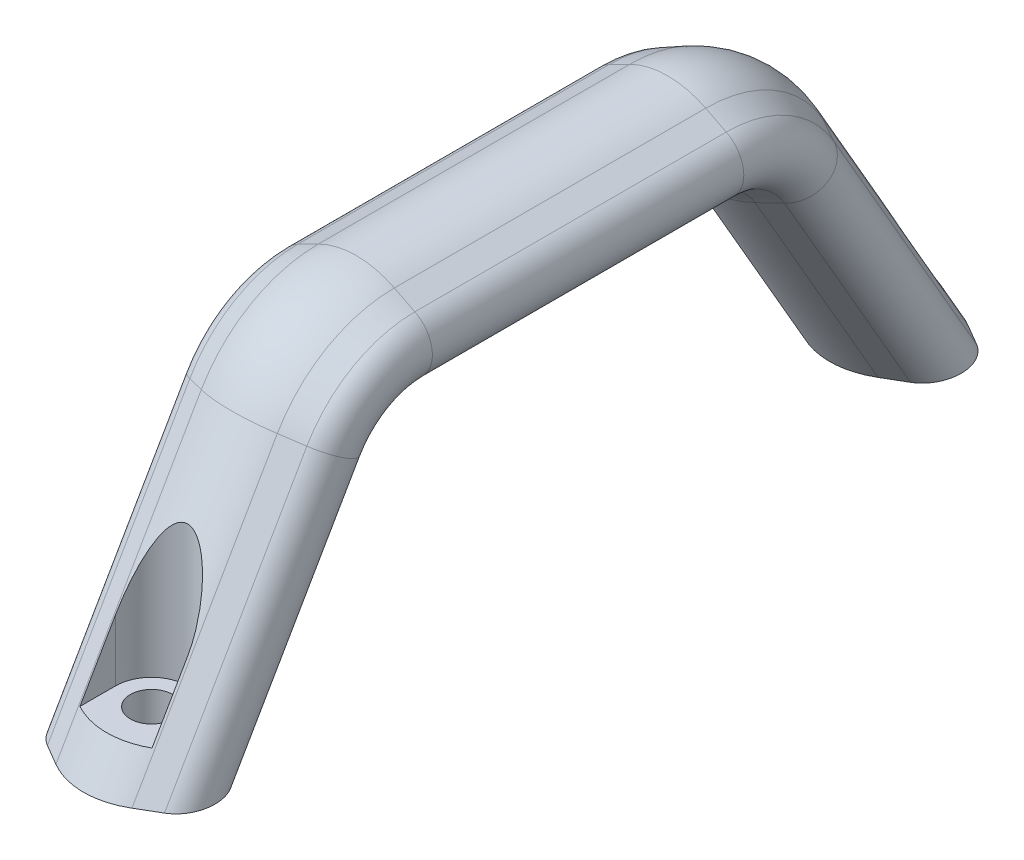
SolidWorks part; units mm, degrees
ref_plane "Front Plane" through (0, 0, 0) normal (0, 0, 1) x (1, 0, 0)
ref_plane "Top Plane" through (0, 0, 0) normal (0, 1, 0) x (1, 0, 0)
ref_plane "Right Plane" through (0, 0, 0) normal (1, 0, 0) x (0, 0, -1)
sketch "Axis_Line_L1" plane through (0, 0, 0) normal (0, 1, 0) x (1, 0, 0)
  line L0 (-7.5, 0) -> (7.5, 0) construction
  line L1 (-7.5, -53.5) -> (7.5, -53.5)
  dimension "FIX_1" = 15
  dimension "L1" = 107
ref_plane "Plane1" through (0, -23.1662, 13.375) normal (0, 0.866, -0.5) x (1, 0, 0)
sketch "Sketch2" plane through (0, 0, 0) normal (1, 0, 0) x (0, 0, -1)
  line L0 (-48.3038, -3) -> (-29.8286, 29)
  line L1 (-19.4363, 35) -> (19.4363, 35)
  line L2 (29.8286, 29) -> (48.3038, -3)
  line L3 (-53.5, 0) -> (-29.8286, 41) construction
  line L4 (-29.8286, 41) -> (29.8286, 41) construction
  line L5 (29.8286, 41) -> (53.5, 0) construction
  line L6 (-43.1077, -6) -> (-22.9004, 29) construction
  line L7 (-22.9004, 29) -> (22.9004, 29) construction
  line L8 (22.9004, 29) -> (43.1077, -6) construction
  line L9 (-42.275, -4.5578) -> (-22.9004, 29) construction
  line L10 (-52.6673, 1.4422) -> (-29.8286, 41) construction
  line L11 (22.9004, 29) -> (43.1077, -6) construction
  line L12 (29.8286, 41) -> (53.5, 0) construction
  line L13 (-47.4712, -1.5578) -> (-26.3645, 35) construction
  line L14 (-53.5, 0) -> (-43.1077, -6) construction
  line L15 (0, 0) -> (0, 41) construction
  line L16 (26.3645, 35) -> (48.3038, -3) construction
  line L17 (-26.3645, 35) -> (26.3645, 35) construction
  arc A0 (19.4363, 35) -> (29.8286, 29) centre (19.4363, 23) cw
  arc A1 (-29.8286, 29) -> (-19.4363, 35) centre (-19.4363, 23) cw
  point P3 (0, 35)
  point P14 (-48.3038, -3)
  dimension "FIX_4" = 12
  dimension "FIX_3" = 120
  dimension "H_s" = 29
  dimension "L1" = 107
  dimension "H" = 41
sketch "Sketch1" plane through (0, 26.75, 99.8324) normal (0, -0.866, 0.5) x (1, 0, 0)
  line L1 (0, -53.5) -> (0, -65.5) construction
  line L2 (-7.3079, -55.9319) -> (-4.7457, -54.6337)
  line L3 (9.5, -59.5) -> (-9.5, -59.5) construction
  line L10 (4.7457, -54.6337) -> (7.3079, -55.9319)
  line L11 (7.3079, -63.0681) -> (4.7457, -64.3663)
  line L12 (-4.7457, -64.3663) -> (-7.3079, -63.0681)
  arc A0 (-7.3079, -55.9319) -> (-7.3079, -63.0681) centre (-5.5, -59.5) ccw
  arc A1 (7.3079, -55.9319) -> (7.3079, -63.0681) centre (5.5, -59.5) cw
  arc A2 (4.7457, -54.6337) -> (-4.7457, -54.6337) centre (0, -64) ccw
  arc A3 (-4.7457, -64.3663) -> (4.7457, -64.3663) centre (0, -55) ccw
  dimension "MSM_20" = 10.5
  dimension "FIX_5" = 4
  dimension "A" = 19
  dimension "MSM_19" = 12
sweep "Sweep1" add profiles "Sketch1" path "Sketch2"
sketch "Sketch3" plane through (0, 0, 0) normal (0, 1, 0) x (1, 0, 0)
  line L1 (-9.5, -53.5) -> (9.5, -53.5)
  line L2 (-9.5, -53.5) -> (-9.5, 53.5)
  line L3 (-9.5, 53.5) -> (9.5, 53.5)
  line L4 (9.5, -53.5) -> (9.5, 53.5)
  line L5 (-9.5, -53.5) -> (9.5, 53.5) construction
  line L6 (-9.5, 53.5) -> (9.5, -53.5) construction
  point P0 (0, 0)
  dimension "A" = 19
  dimension "L1" = 107
extrude "Cut-Extrude1" cut sketch "Sketch3" against normal through all
sketch "Sketch4" plane through (0, 0, 0) normal (1, 0, 0) x (0, 0, -1)
  line L0 (45, 0) -> (45, 41) construction
  line L1 (45, 41) -> (49.5, 41)
  line L2 (49.5, 41) -> (49.5, 5)
  line L3 (49.5, 5) -> (47.65, 5)
  line L4 (47.65, 5) -> (47.65, 0)
  line L5 (47.65, 0) -> (45, 0)
  line L6 (0, 0) -> (0, 41) construction
  line L7 (45, 41) -> (45, 0)
  dimension "R" = 5.3
  dimension "Lr" = 5
  dimension "C" = 9
  dimension "L" = 90
  dimension "H" = 41
revolve "Cut-Revolve1" cut sketch "Sketch4" angle 360 about L7
sketch "Sketch5" plane through (0, 0, 0) normal (1, 0, 0) x (0, 0, -1)
  line L0 (45, 5) -> (45, 29)
  line L1 (45, 29) -> (53.5, 29)
  line L2 (53.5, 29) -> (53.5, 5)
  line L3 (53.5, 5) -> (45, 5)
  line L5 (0, 0) -> (0, 29) construction
  dimension "Lr" = 5
  dimension "L" = 90
  dimension "L1" = 107
  dimension "H_s" = 29
extrude "Cut-Extrude2" cut sketch "Sketch5" against normal mid plane 9
mirror "Mirror1" about plane through (0, 0, 0) normal (0, 0, 1) of "Cut-Extrude2", "Cut-Revolve1"
